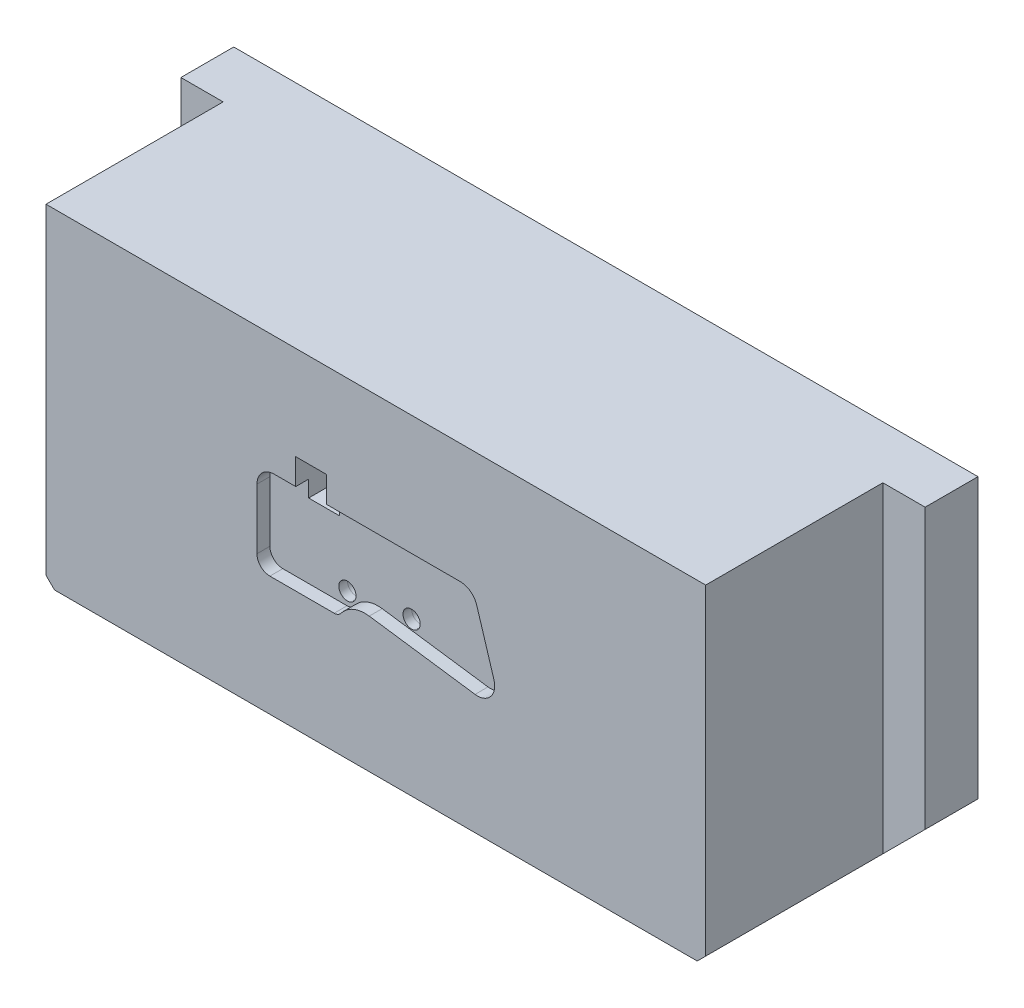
SolidWorks part; units mm, degrees
ref_plane "Plan de joint moule PF" through (0, 0, 0) normal (0, 0, 1) x (1, 0, 0)
ref_plane "dessus" through (0, 0, 0) normal (0, 1, 0) x (1, 0, 0)
ref_plane "Plan de joint tiroir PF" through (0, 0, 0) normal (1, 0, 0) x (0, 0, -1)
sketch "Esquisse1" plane through (0, 0, 0) normal (0, 0, 1) x (1, 0, 0)
  line L0 (-39, 19.5) -> (-39, -18.5) construction
  line L1 (-39, 19.5) -> (-39, -18.5)
  line L2 (-39, 19.5) -> (39, 19.5) construction
  line L3 (-39, 19.5) -> (39, 19.5)
  line L4 (39, 19.5) -> (39, -18.5) construction
  line L5 (39, 19.5) -> (39, -18.5)
  line L6 (-38, -19.5) -> (38, -19.5) construction
  line L7 (-38, -19.5) -> (38, -19.5)
  line L8 (44, -13.5) -> (38, -19.5) construction
  line L9 (39, -18.5) -> (38, -19.5)
  line L10 (-44, -13.5) -> (-38, -19.5) construction
  line L11 (-39, -18.5) -> (-38, -19.5)
extrude "78 X F" add sketch "Esquisse1" against normal blind 20.95
sketch "Esquisse2" plane through (0, 0, -20.95) normal (0, 0, -1) x (-1, 0, 0)
  line L0 (39, 19.5) -> (-39, 19.5) construction
  line L1 (44, 19.5) -> (44, -13.5) construction
  line L2 (44, -13.5) -> (38, -19.5) construction
  line L3 (38, -19.5) -> (-38, -19.5) construction
  line L4 (-44, -13.5) -> (-38, -19.5) construction
  line L5 (-44, 19.5) -> (-44, -13.5) construction
  line L6 (44, 19.5) -> (-44, 19.5)
  line L7 (44, 19.5) -> (44, -13.5)
  line L8 (44, -13.5) -> (38, -19.5)
  line L9 (38, -19.5) -> (-38, -19.5)
  line L10 (-44, -13.5) -> (-38, -19.5)
  line L11 (-44, 19.5) -> (-44, -13.5)
extrude "Boss.-Extru.1" add sketch "Esquisse2" along normal blind 6.25
sketch "Epure doigt de démoulage" plane through (-29.1473, 3, -10.7247) normal (0, 1, 0) x (-1, 0, 0)
  line L1 (-54.2284, 48.3479) -> (-34.0662, -26.8985) construction
  line L2 (-35.1675, -7.3337) -> (-47.332, 38.0648)
  line L3 (-33.2356, -6.8161) -> (-35.1675, -7.3337)
  line L4 (-44.1473, 42.1518) -> (-44.1473, -22.7507) construction
  line L5 (-30.6475, -16.4753) -> (-36.443, -18.0283)
  line L6 (-30.6475, -16.4753) -> (-33.2356, -6.8161)
  line L9 (-47.332, 38.0648) -> (-48.6635, 40.9201)
  line L10 (-47.332, 38.0648) -> (-53.3895, 36.4417) construction
  line L11 (-36.443, -18.0283) -> (-52.7486, 42.8251)
  line L12 (14.8527, -16.4753) -> (-73.1473, -16.4753) construction
  line L13 (20.8527, 10.7247) -> (-79.1473, 10.7247) construction
  line L14 (-29.1473, 60.7247) -> (-29.1473, -39.2753) construction
  arc A0 (-48.6635, 40.9201) -> (-52.7486, 42.8251) centre (-51.8411, 39.4384) ccw
  point P0 (-44.1473, 10.7247)
  point P12 (-36.443, -18.0283)
  dimension "D1" = 15
  dimension "D2 angle alpha" = 15
  dimension "C" = 12
  dimension "D" = 8
  dimension "E1" = 10
  dimension "D5" = 10
  dimension "Longueur" = 63
  dimension "e" = 6
other "Empreinte1"
other "Carter<1>@jeu blocs empreintes droit_Etudiant_Corrigé"
sketch "Esquisse3" plane through (0, 0, 0) normal (0, 0, 1) x (1, 0, 0)
  line L4 (-0.7787, -3.5686) -> (0.2024, -3.7065) construction
  line L5 (-0.7787, -3.5686) -> (0.2024, -3.7065)
  line L6 (-9.7467, -5.3471) -> (-4.9262, -5.3471) construction
  line L7 (-9.7467, -5.3471) -> (-4.9262, -5.3471)
  arc A4 (0.2024, -3.7065) -> (-9.7467, -5.3471) centre (-4.8888, -3.8194) ccw construction
  arc A5 (0.2024, -3.7065) -> (-9.7467, -5.3471) centre (-4.8888, -3.8194) ccw
  arc A6 (-0.7787, -3.5686) -> (-4.1148, -4.9442) centre (-1.2748, -7.0987) ccw construction
  arc A7 (-0.7787, -3.5686) -> (-4.1148, -4.9442) centre (-1.2748, -7.0987) ccw
  arc A8 (-4.9262, -5.3471) -> (-4.1148, -4.9442) centre (-4.9262, -4.3286) ccw construction
  arc A9 (-4.9262, -5.3471) -> (-4.1148, -4.9442) centre (-4.9262, -4.3286) ccw
extrude "Nettoyage d'empreinte" cut sketch "Esquisse3" against normal up to surface (1.5277 mm away)
sketch "Esquisse4" plane through (0, 0, 0) normal (0, 0, 1) x (1, 0, 0)
  line L0 (-5.8055, 3.412) -> (-9.4721, 3.412) construction
  line L1 (-5.8055, 3.412) -> (-9.4721, 3.412)
  line L2 (-5.8055, 5.3471) -> (-5.8055, 3.412) construction
  line L3 (-5.8055, 8.412) -> (-5.8055, 3.412)
  line L4 (-9.4721, 3.412) -> (-9.4721, 5.3471) construction
  line L5 (-9.4721, 3.412) -> (-9.4721, 8.412)
  line L6 (-5.8055, 8.412) -> (-9.4721, 8.412)
  circle A1 centre (-4.8888, -3.8194) radius 1.0096
  circle A2 centre (-4.8888, -3.8194) radius 1.0096
  circle A3 centre (2.699, -2.9027) radius 1.0096
  circle A4 centre (2.699, -2.9027) radius 1.0096
  dimension "D1" = 5
  dimension "D2" = 0
  dimension "D3" = 0
extrude "Dégagement pour passage broche" cut sketch "Esquisse4" against normal through all
sketch "Esquisse5" plane through (0, 0, -27.2) normal (0, 0, -1) x (-1, 0, 0)
  circle A0 centre (-2.699, -2.9027) radius 2.1
  circle A1 centre (4.8888, -3.8194) radius 2.1
  dimension "D1" = 4.2
extrude "Lamage Broche" cut sketch "Esquisse5" against normal blind 2
sketch "Esquisse6" plane through (0, 0, -27.2) normal (0, 0, -1) x (-1, 0, 0)
  line L0 (2.2864, 5.912) -> (12.0989, 5.912) construction
  line L1 (5.8055, 3.412) -> (5.8055, 8.412) construction
  line L2 (3.8055, 7.412) -> (11.4721, 7.412)
  line L3 (3.8055, 4.412) -> (11.4721, 4.412)
  line L4 (9.4721, 8.412) -> (9.4721, 3.412) construction
  arc A0 (3.8055, 7.412) -> (3.8055, 4.412) centre (3.8055, 5.912) ccw
  arc A1 (11.4721, 4.412) -> (11.4721, 7.412) centre (11.4721, 5.912) ccw
  point P2 (5.8055, 5.912)
  dimension "D1" = 2
  dimension "D3" = 1.5
  dimension "D2" = 2
extrude "Lamage pour goupille" cut sketch "Esquisse6" against normal blind 2.4
sketch "Esquisse7" plane through (0, 0, -25.2) normal (0, 0, -1) x (-1, 0, 0)
  circle A1 centre (-2.699, -2.9027) radius 1.1
  circle A2 centre (-2.699, -2.9027) radius 1.1
  circle A3 centre (4.8888, -3.8194) radius 1.1
  circle A4 centre (4.8888, -3.8194) radius 1.1
  dimension "D1" = 0
  dimension "D2" = 0
extrude "Percage 2,2 mm" cut sketch "Esquisse7" against normal offset from surface (16.6538 mm away) 6
sketch "Esquisse8" plane through (0, 0, 0) normal (0, 0, 1) x (1, 0, 0)
  circle A0 centre (-4.8888, -3.8194) radius 1.0185 construction
  point P0 (-4.8888, -3.8194)
ref_plane "Plan coupe" through (0.3844, -3.1823, 0) normal (0.1199, -0.9928, 0) x (0.9928, 0.1199, 0)
